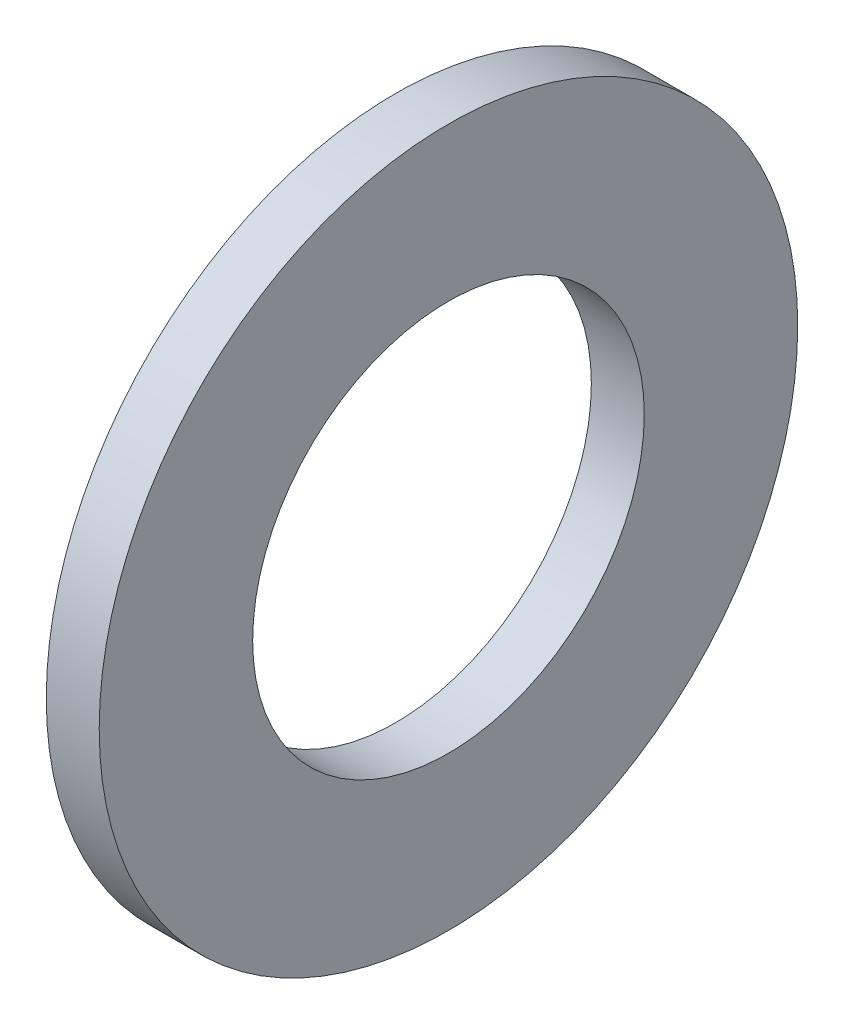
SolidWorks part; units mm, degrees
ref_plane "Plane1" through (0, 0, 0) normal (0, 0, 1) x (1, 0, 0)
ref_plane "Plane2" through (0, 0, 0) normal (0, 1, 0) x (1, 0, 0)
ref_plane "Plane3" through (0, 0, 0) normal (1, 0, 0) x (0, 0, -1)
other "Configuration Table"
sketch "Sketch1" plane through (0, 0, 0) normal (0, 0, 1) x (1, 0, 0)
  line L0 (-34.925, 0) -> (9.525, 0) construction
  line L1 (0, 18.5) -> (0, 33)
  line L2 (0, 33) -> (-5, 33)
  line L3 (-5, 33) -> (-5, 18.5)
  line L4 (-5, 18.5) -> (0, 18.5)
  dimension "Thickness" = 5
  dimension "Inside_dia" = 37
  dimension "Outside_dia" = 66
revolve "Base-Revolve" add sketch "Sketch1" angle 360 about L0
